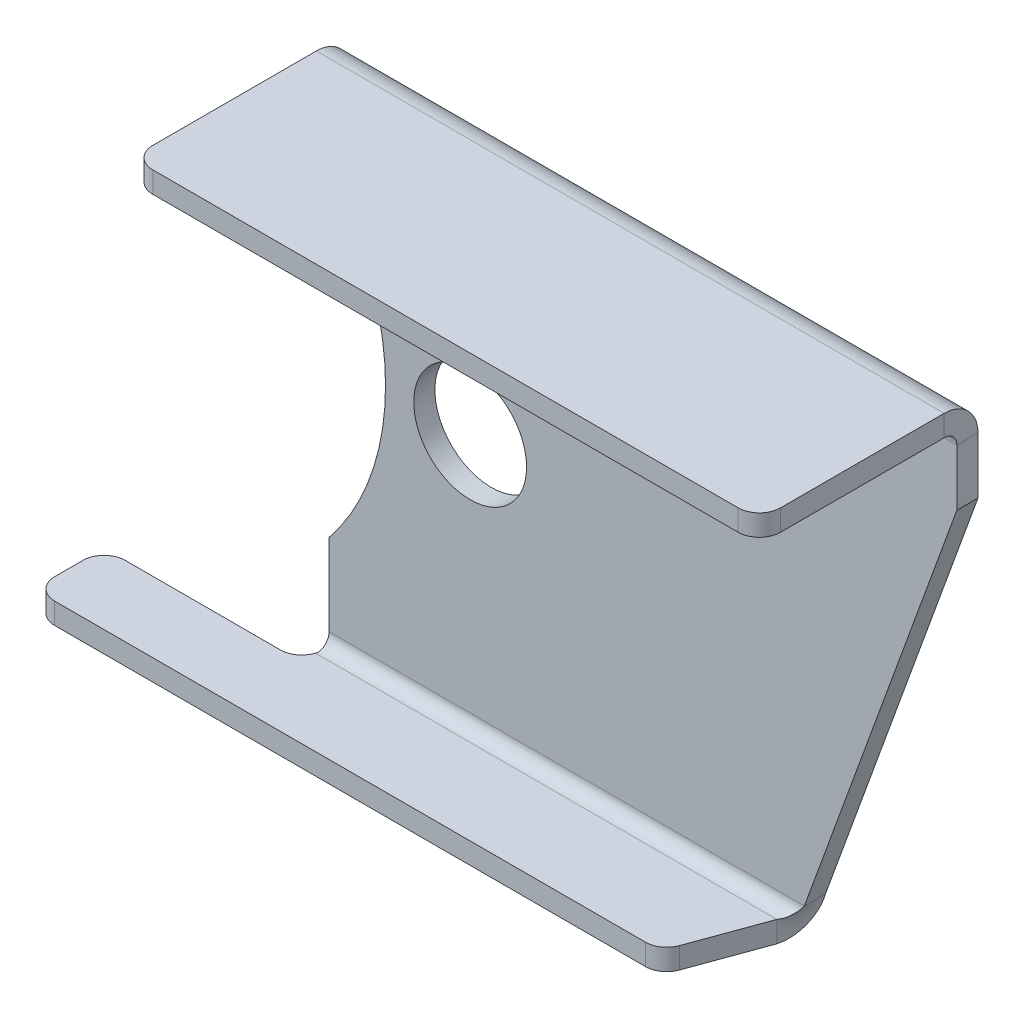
SolidWorks part; units mm, degrees
ref_plane "Plan1" through (0, 0, 0) normal (0, 0, 1) x (1, 0, 0)
ref_plane "Plan2" through (0, 0, 0) normal (0, 1, 0) x (1, 0, 0)
ref_plane "Plan3" through (0, 0, 0) normal (1, 0, 0) x (0, 0, -1)
sketch "Esquisse1" plane through (0, 0, 0) normal (0, 0, 1) x (1, 0, 0)
  line L1 (-7.93, -37.1) -> (129.26, -37.1) construction
  line L2 (117, 62.2) -> (117, 25.2)
  line L3 (28, 62.2) -> (28, 22.6274)
  line L5 (31, 65.2) -> (114, 65.2)
  line L6 (117, 25.2) -> (89.5836, -50.1261)
  line L7 (0, 0) -> (54.7018, 0) construction
  line L8 (48, 7.58) -> (48, -17.82) construction
  line L9 (28, -22.6274) -> (28, -39.1)
  line L10 (24.04, 36.1) -> (120.55, 36.1) construction
  line L12 (72.5, 65.2) -> (72.5, 35.77) construction
  line L13 (3, -42.1) -> (25, -42.1)
  line L14 (0, -45.1) -> (0, -49.1)
  line L15 (3, -52.1) -> (86.7645, -52.1)
  arc A0 (28, -22.6274) -> (28, 22.6274) centre (0, 0) ccw
  circle A1 centre (48, 0) radius 8
  arc A2 (114, 65.2) -> (117, 62.2) centre (114, 62.2) cw
  arc A3 (25, -42.1) -> (28, -39.1) centre (25, -39.1) ccw
  arc A4 (28, 62.2) -> (31, 65.2) centre (31, 62.2) cw
  arc A5 (86.7645, -52.1) -> (89.5836, -50.1261) centre (86.7645, -49.1) ccw
  arc A6 (0, -45.1) -> (3, -42.1) centre (3, -45.1) cw
  arc A7 (3, -52.1) -> (0, -49.1) centre (3, -49.1) cw
  dimension "D5" = 36
  dimension "D16" = 5
  dimension "D4" = 65.2
  dimension "D9" = 3
  dimension "D11" = 16
  dimension "D17" = 160
  dimension "D15" = 15
  dimension "D6" = 28
  dimension "D7" = 44.5
  dimension "D12" = 3
  dimension "D1" = 36.1
  dimension "D2" = 20
  dimension "D8" = 29.1
  dimension "D10" = 37.1
  dimension "D14" = 40
extrude "Base-Extrusion" add sketch "Esquisse1" along normal mid plane 3
sheet metal parameters "Tôlerie 1" parameters "D1"=1.8
flatten bends "Dépliage 1" parameters "D1"=1.8
sketch "Esquisse-Angle1" plane through (0, 0, 1.5) normal (0, 0, 1) x (1, 0, 0)
process bends "Pliage 1" parameters "D1"=1.8
sketch "Esquisse-Plate1" plane through (0, 0, 1.5) normal (0, 0, 1) x (1, 0, 0)
  line L0 (24.04, 36.1) -> (120.55, 36.1) construction
  line L3 (24.04, 36.1) -> (120.55, 36.1)
  line L4 (-7.93, -37.1) -> (129.26, -37.1) construction
  line L5 (-7.93, -37.1) -> (129.26, -37.1)
bend "Pli défini à plat1" bend angle 90 parameters "D1"=0, "D5"=1
bend "Pli défini à plat2" bend angle 90 parameters "D1"=0, "D5"=2
